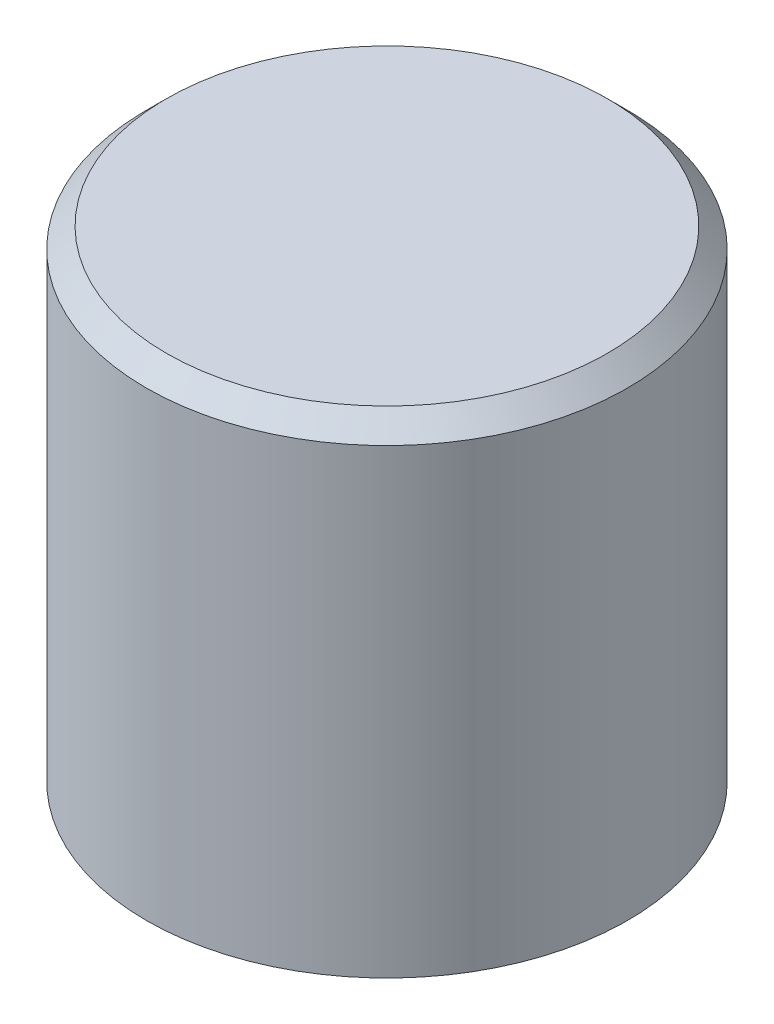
SolidWorks part; units mm, degrees
ref_plane "Front Plane" through (0, 0, 0) normal (0, 0, 1) x (1, 0, 0)
ref_plane "Top Plane" through (0, 0, 0) normal (0, 1, 0) x (1, 0, 0)
ref_plane "Right Plane" through (0, 0, 0) normal (1, 0, 0) x (0, 0, -1)
sketch "Sketch1" plane through (0, 0, 0) normal (0, 0, 1) x (1, 0, 0)
  line L0 (0, 0) -> (0, -7113.7616) construction
  line L1 (0, 0) -> (7113.7616, 0) construction
  line L2 (0, 12) -> (-6, 12)
  line L4 (-6, 12) -> (-6, 0)
  line L5 (-6, 0) -> (-5, 0)
  line L6 (-5, 0) -> (-5, 3)
  line L7 (-5, 3) -> (-1.5, 3.6171)
  line L8 (-1.5, 3.6171) -> (-1.5, 8.5)
  line L9 (-1.5, 8.5) -> (0, 8.5)
  line L10 (0, 12) -> (0, 8.5)
  point P7 (-6, 12)
  point P12 (0, 0)
  dimension "D1" = 12
  dimension "D2" = 3
  dimension "D3" = 100
  dimension "D4" = 8.5
  dimension "D6" = 10
  dimension "D7" = 3
  dimension "D8" = 12
revolve "Revolve2" add sketch "Sketch1" angle 360 about L0
chamfer "Chamfer1" distance 0.5 angle 45 1 edges at (0, 12, 6)
chamfer "Chamfer2" distance 0.1 angle 45 1 edges at (0, 3.6171, 1.5)
